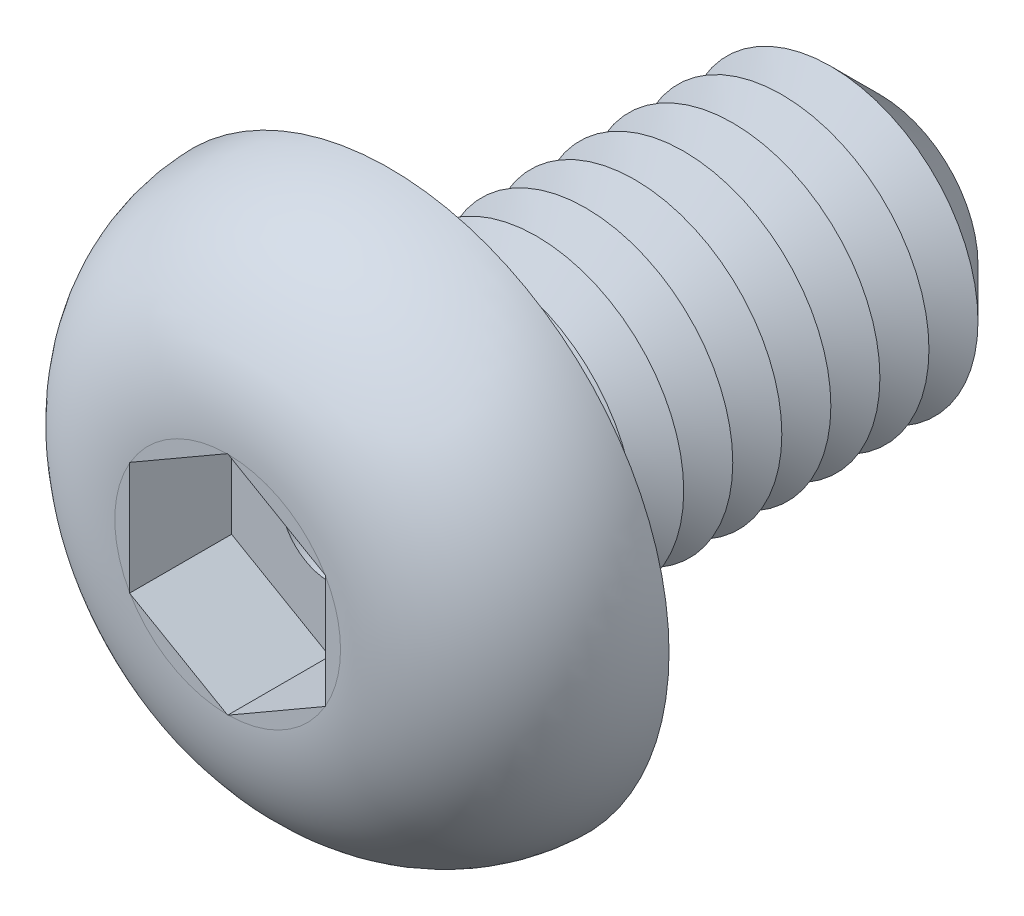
SolidWorks part; units mm, degrees
ref_plane "Front Plane" through (0, 0, 0) normal (0, 0, 1) x (1, 0, 0)
ref_plane "Top Plane" through (0, 0, 0) normal (0, 1, 0) x (1, 0, 0)
ref_plane "Right Plane" through (0, 0, 0) normal (1, 0, 0) x (0, 0, -1)
sketch "Sketch1" plane through (0, 0, 0) normal (1, 0, 0) x (0, 0, -1)
  line L0 (-47.9342, 0) -> (60.3146, 0) construction
sketch "Sketch2" plane through (0, 0, 0) normal (1, 0, 0) x (0, 0, -1)
  line L0 (0, 0) -> (-1.65, 0)
  line L1 (-47.9342, 0) -> (60.3146, 0) construction
  line L2 (-1.65, 0) -> (-1.65, 1.1507)
  line L3 (0, 2.85) -> (0, 0)
  arc A0 (-1.65, 1.1507) -> (0, 2.85) centre (0.05, 1.1507) cw
  dimension "D1" = 1.7
  dimension "D2" = 1.65
  dimension "D3" = 2.85
revolve "Revolve1" add sketch "Sketch2" angle 360 about L0
sketch "Sketch3" plane through (0, 0, 1.65) normal (0, 0, 1) x (1, 0, 0)
  line L1 (0, 1.1547) -> (-1, 0.5774)
  line L2 (-1, 0.5774) -> (-1, -0.5774)
  line L3 (-1, -0.5774) -> (0, -1.1547)
  line L4 (0, -1.1547) -> (1, -0.5774)
  line L5 (1, -0.5774) -> (1, 0.5774)
  line L6 (1, 0.5774) -> (0, 1.1547)
  circle A0 centre (0, 0) radius 1 construction
  dimension "D1" = 2
extrude "Cut-Extrude1" cut sketch "Sketch3" against normal blind 1.04
sketch "Sketch4" plane through (0, 0, 0) normal (0, 0, -1) x (-1, 0, 0)
  circle A0 centre (0, 0) radius 1.5
  dimension "D1" = 3
extrude "Boss-Extrude1" add sketch "Sketch4" along normal blind 5
chamfer "Chamfer1" distance 0.5 angle 45 1 edges at (-1.5, 0, -5)
sketch "Sketch5" plane through (0, 0, 0) normal (1, 0, 0) x (0, 0, -1)
  line L0 (0.5, 1.5) -> (1, 1.5)
  line L1 (4.5, 1.5) -> (0, 1.5) construction
  line L2 (1, 1.5) -> (0.75, 1.067)
  line L3 (0.75, 1.067) -> (0.5, 1.5)
  line L4 (0, -2.85) -> (0, 2.85) construction
  line L5 (4.5, 1.5) -> (0, 1.5) construction
  dimension "D1" = 0.5
  dimension "D2" = 0.5
revolve "Cut-Revolve1" cut sketch "Sketch5" angle 360 about L0
pattern_linear "LPattern1" count 8 spacing 0.5 along (0, 0, -1) of "Cut-Revolve1"
fillet "Fillet2" radius 0.25 1 edges at (1.5, 0, 0)
sketch "Sketch6" plane through (0, 0, 0.61) normal (0, 0, 1) x (1, 0, 0)
  circle A0 centre (0, 0) radius 0.5
  dimension "D1" = 1
extrude "Cut-Extrude2" cut sketch "Sketch6" against normal up to surface (5.61 mm away)
